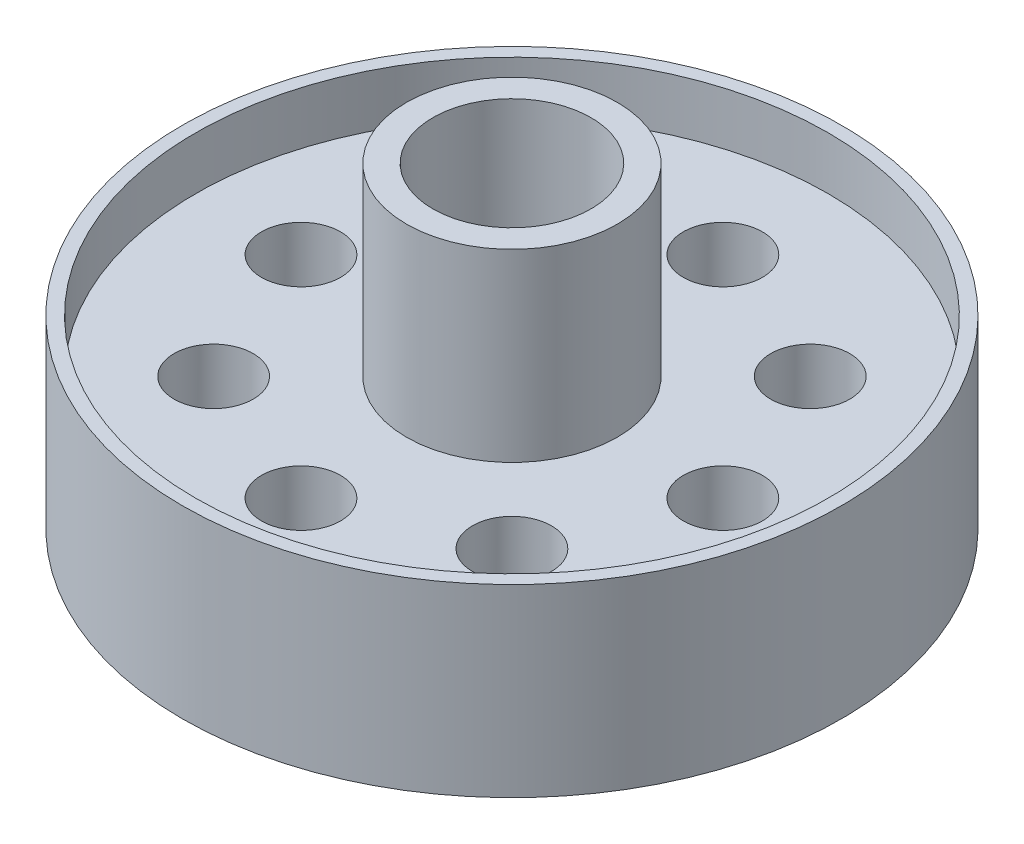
SolidWorks part; units mm, degrees
ref_plane "Front" through (0, 0, 0) normal (0, 0, 1) x (1, 0, 0)
ref_plane "Top" through (0, 0, 0) normal (0, 1, 0) x (1, 0, 0)
ref_plane "Right" through (0, 0, 0) normal (1, 0, 0) x (0, 0, -1)
sketch "Sketch1" plane through (0, 0, 0) normal (0, 1, 0) x (1, 0, 0)
  circle A0 centre (0, 0) radius 12.5
extrude "Extrude1" add sketch "Sketch1" along normal blind 7
sketch "Sketch2" plane through (0, 7, 0) normal (0, 1, 0) x (-1, 0, 0)
  circle A0 centre (0, 0) radius 12
extrude "Cut-Extrude1" cut sketch "Sketch2" against normal blind 2
sketch "Sketch3" plane through (0, 0, 0) normal (0, -1, 0) x (1, 0, 0)
  circle A0 centre (0, 0) radius 12
extrude "Cut-Extrude2" cut sketch "Sketch3" against normal blind 2
sketch "Sketch4" plane through (0, 5, 0) normal (0, 1, 0) x (-1, 0, 0)
  circle A0 centre (0, 0) radius 4
extrude "Extrude2" add sketch "Sketch4" along normal blind 7
sketch "Sketch5" plane through (0, 2, 0) normal (0, -1, 0) x (1, 0, 0)
  circle A0 centre (0, 0) radius 4
extrude "Extrude3" add sketch "Sketch5" along normal blind 2
sketch "Sketch6" plane through (0, 12, 0) normal (0, 1, 0) x (-1, 0, 0)
  circle A0 centre (0, 0) radius 3
extrude "Cut-Extrude3" cut sketch "Sketch6" against normal through all
sketch "Sketch7" plane through (0, 5, 0) normal (0, 1, 0) x (-1, 0, 0)
  circle A1 centre (0, 8) radius 1.5
  circle A2 centre (5.6569, 5.6569) radius 1.5
  circle A3 centre (8, 0) radius 1.5
  circle A4 centre (5.6569, -5.6569) radius 1.5
  circle A5 centre (0, -8) radius 1.5
  circle A6 centre (-5.6569, -5.6569) radius 1.5
  circle A7 centre (-8, 0) radius 1.5
  circle A8 centre (-5.6569, 5.6569) radius 1.5
extrude "Cut-Extrude4" cut sketch "Sketch7" against normal blind 12
